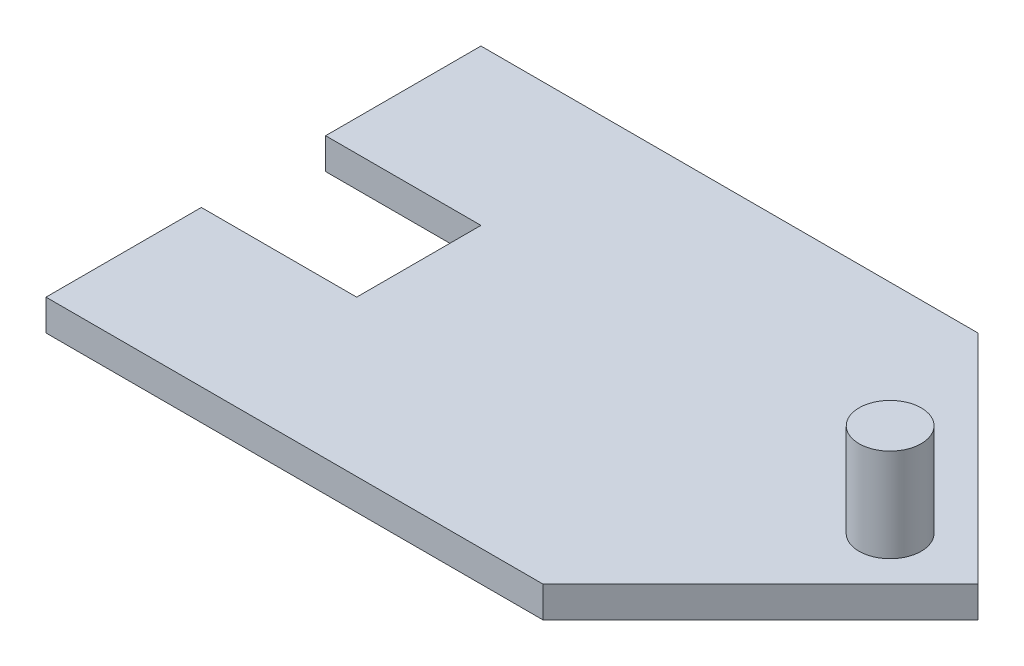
SolidWorks part; units mm, degrees
ref_plane "Front Plane" through (0, 0, 0) normal (0, 0, 1) x (1, 0, 0)
ref_plane "Top Plane" through (0, 0, 0) normal (0, 1, 0) x (1, 0, 0)
ref_plane "Right Plane" through (0, 0, 0) normal (1, 0, 0) x (0, 0, -1)
sketch "Sketch1" plane through (0, 0, 0) normal (0, 1, 0) x (1, 0, 0)
  line L0 (0, 0) -> (80, 0)
  line L1 (80, 0) -> (115, 35)
  line L2 (115, 35) -> (80, 70)
  line L3 (80, 70) -> (0, 70)
  line L4 (0, 70) -> (0, 45)
  line L5 (0, 45) -> (25, 45)
  line L6 (25, 45) -> (25, 25)
  line L7 (25, 25) -> (0, 25)
  line L8 (0, 25) -> (0, 0)
  dimension "D1" = 80
  dimension "D2" = 25
  dimension "D3" = 70
  dimension "D4" = 25
  dimension "D5" = 135
  dimension "D6" = 25
extrude "Extrude1" add sketch "Sketch1" along normal blind 5
sketch "Sketch2" plane through (0, 5, 0) normal (0, 1, 0) x (-1, 0, 0)
  line L0 (-115, -35) -> (-80, -70) construction
  line L1 (-80, 0) -> (-115, -35) construction
  circle A0 centre (-100.8579, -35) radius 5
  dimension "D1" = 10
  dimension "D2" = 10
  dimension "D3" = 10
extrude "Extrude2" add sketch "Sketch2" along normal blind 15
